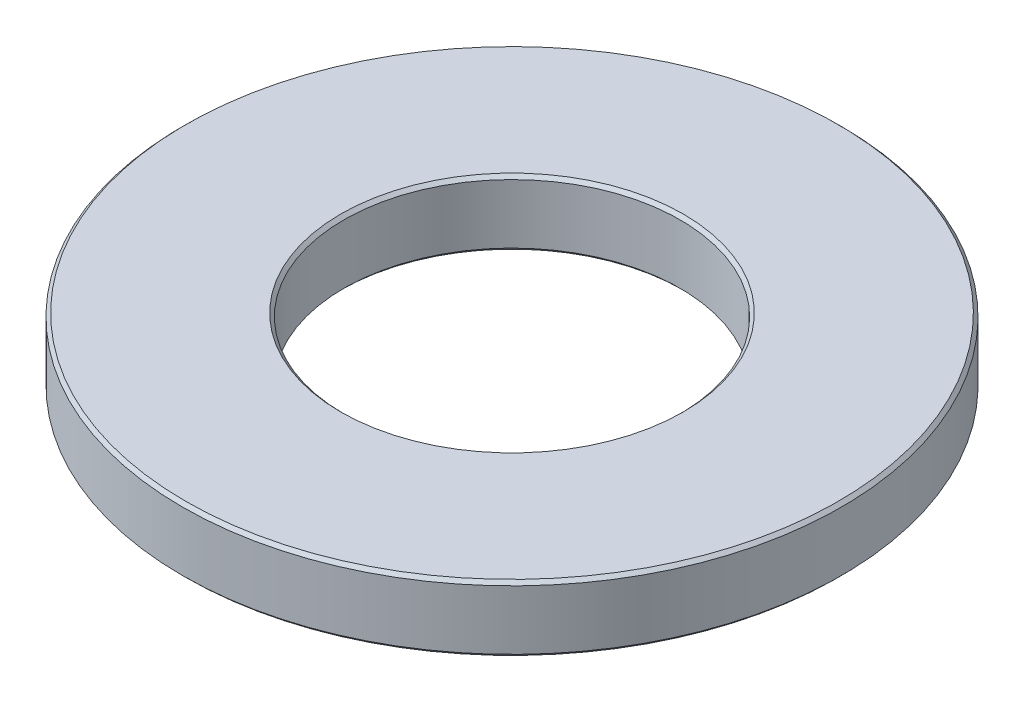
SolidWorks part; units mm, degrees
ref_plane "Plan1" through (0, 0, 0) normal (0, 0, 1) x (1, 0, 0)
ref_plane "Plan2" through (0, 0, 0) normal (0, 1, 0) x (1, 0, 0)
ref_plane "Plan3" through (0, 0, 0) normal (1, 0, 0) x (0, 0, -1)
sketch "Esquisse1" plane through (0, 0, 0) normal (0, 1, 0) x (1, 0, 0)
  circle A0 centre (0, 0) radius 10
  circle A1 centre (0, 0) radius 5.1
  dimension "D1" = 10.2
extrude "Base-Extrusion" add sketch "Esquisse1" along normal blind 2
chamfer "Chanfrein1" distance 0.1 angle 45
